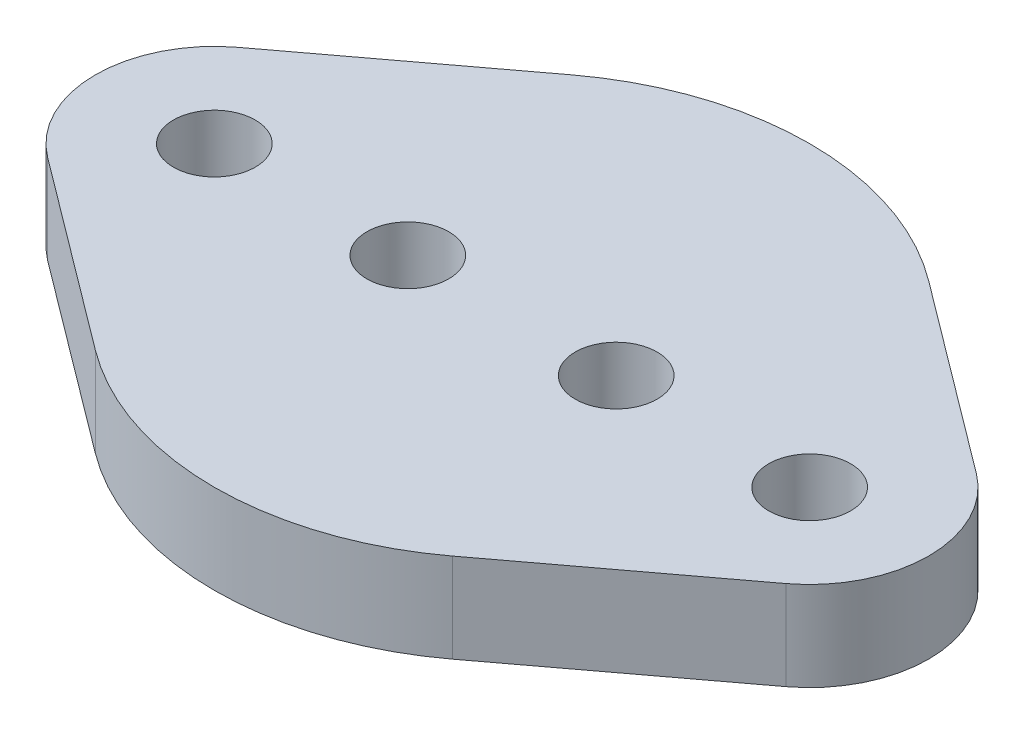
SolidWorks part; units mm, degrees
ref_plane "Front" through (0, 0, 0) normal (0, 0, 1) x (1, 0, 0)
ref_plane "Top" through (0, 0, 0) normal (0, 1, 0) x (1, 0, 0)
ref_plane "Right" through (0, 0, 0) normal (1, 0, 0) x (0, 0, -1)
sketch "Sketch1" plane through (0, 0, 0) normal (0, 1, 0) x (1, 0, 0)
  line L0 (12, 16) -> (24.8, 6.4)
  line L2 (-12, -16) -> (-24.8, -6.4)
  line L3 (12, -16) -> (24.8, -6.4)
  line L4 (-12, 16) -> (-24.8, 6.4)
  arc A0 (-12, -16) -> (12, -16) centre (0, 0) ccw
  circle A1 centre (7, 0) radius 2.75
  circle A2 centre (20, 0) radius 2.75
  arc A3 (24.8, -6.4) -> (24.8, 6.4) centre (20, 0) ccw
  arc A4 (12, 16) -> (-12, 16) centre (0, 0) ccw
  arc A5 (-24.8, -6.4) -> (-24.8, 6.4) centre (-20, 0) cw
  circle A6 centre (-20, 0) radius 2.75
  circle A7 centre (-7, 0) radius 2.75
extrude "Extrude1" add sketch "Sketch1" along normal blind 6
